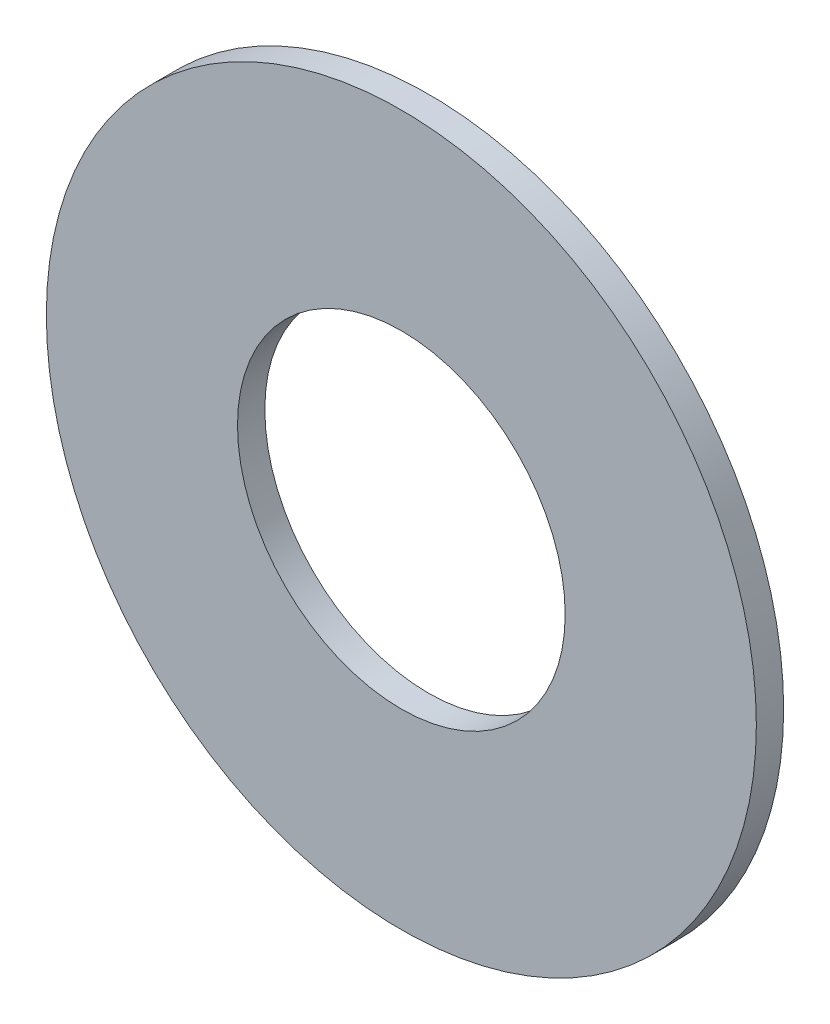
SolidWorks part; units mm, degrees
ref_plane "Plan de face" through (0, 0, 0) normal (0, 0, 1) x (1, 0, 0)
ref_plane "Plan de dessus" through (0, 0, 0) normal (0, 1, 0) x (1, 0, 0)
ref_plane "Plan de droite" through (0, 0, 0) normal (1, 0, 0) x (0, 0, -1)
sketch "Esquisse1" plane through (0, 0, 0) normal (0, 0, 1) x (1, 0, 0)
  circle A0 centre (0, 0) radius 6.5
  circle A1 centre (0, 0) radius 3
  dimension "D1" = 13
  dimension "D2" = 6
extrude "Extrusion1" add sketch "Esquisse1" along normal blind 0.5
